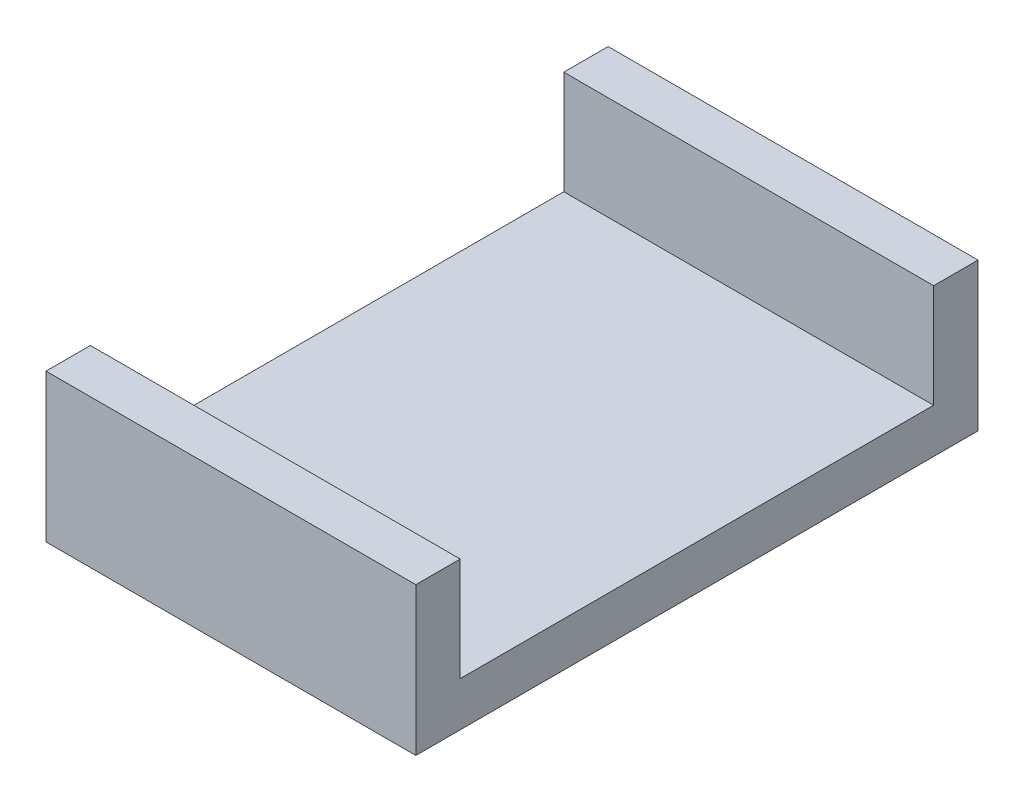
SolidWorks part; units mm, degrees
ref_plane "Front Plane" through (0, 0, 0) normal (0, 0, 1) x (1, 0, 0)
ref_plane "Top Plane" through (0, 0, 0) normal (0, 1, 0) x (1, 0, 0)
ref_plane "Right Plane" through (0, 0, 0) normal (1, 0, 0) x (0, 0, -1)
sketch "Sketch1" plane through (0, 0, 0) normal (1, 0, 0) x (0, 0, -1)
  line L0 (-38.5131, 22.7925) -> (-6.5131, 22.7925)
  line L1 (-38.5131, 22.7925) -> (-38.5131, 29.7925)
  line L2 (-6.5131, 22.7925) -> (-6.5131, 29.7925)
  line L3 (-38.5131, 29.7925) -> (-41.5131, 29.7925)
  line L4 (-6.5131, 29.7925) -> (-3.5131, 29.7925)
  line L5 (-41.5131, 29.7925) -> (-41.5131, 19.7925)
  line L6 (-41.5131, 19.7925) -> (-3.5131, 19.7925)
  line L7 (-3.5131, 19.7925) -> (-3.5131, 29.7925)
extrude "Boss-Extrude1" add sketch "Sketch1" along normal blind 25
